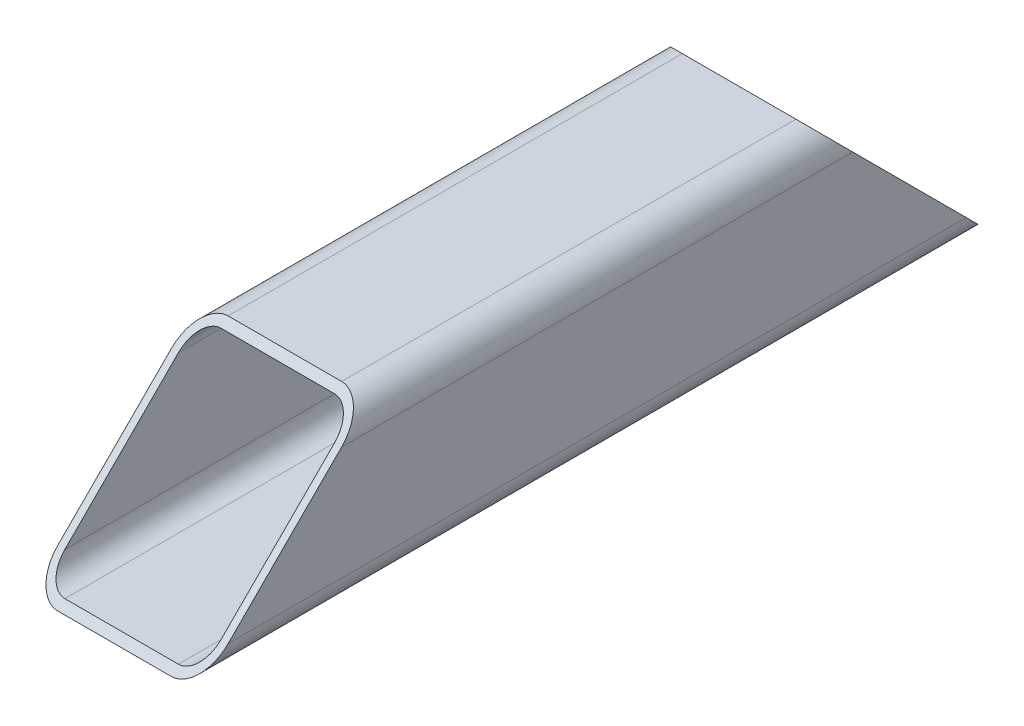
SolidWorks part; units mm, degrees
ref_plane "Front" through (0, 0, 0) normal (0, 0, 1) x (1, 0, 0)
ref_plane "Top" through (0, 0, 0) normal (0, 1, 0) x (1, 0, 0)
ref_plane "Right" through (0, 0, 0) normal (1, 0, 0) x (0, 0, -1)
sketch "Sketch1" plane through (0, 0, 0) normal (0, 0, 1) x (1, 0, 0)
  line L0 (-25.4, 38.1) -> (25.4, 38.1)
  line L1 (-38.1, 25.4) -> (-38.1, -25.4)
  line L2 (25.4, -38.1) -> (-25.4, -38.1)
  line L3 (38.1, -25.4) -> (38.1, 25.4)
  line L4 (0, 38.1) -> (0, -38.1) construction
  arc A0 (38.1, 25.4) -> (25.4, 38.1) centre (25.4, 25.4) ccw
  arc A1 (38.1, -25.4) -> (25.4, -38.1) centre (25.4, -25.4) cw
  arc A2 (-25.4, -38.1) -> (-38.1, -25.4) centre (-25.4, -25.4) cw
  arc A3 (-38.1, 25.4) -> (-25.4, 38.1) centre (-25.4, 25.4) cw
  dimension "D1" = 12.7
  dimension "D2" = 76.2
  dimension "D3" = 76.2
extrude "Base-Extrude-Thin" add sketch "Sketch1" along normal blind 355.6 thin
sketch "Sketch2" plane through (38.1, 0, 0) normal (1, 0, 0) x (0, 0, -1)
  line L0 (-355.6, -38.1) -> (-279.4, 38.1)
  line L1 (-355.6, 38.1) -> (0, 38.1) construction
  line L2 (-355.6, -25.4) -> (-355.6, 25.4) construction
  dimension "D1" = 45
extrude "Cut-Extrude1" cut sketch "Sketch2" against normal through all
sketch "Sketch3" plane through (38.1, 0, 0) normal (1, 0, 0) x (0, 0, -1)
  line L0 (0, -38.1) -> (-76.2, 38.1)
  line L1 (0, -25.4) -> (0, 25.4) construction
  line L2 (-279.4, 38.1) -> (0, 38.1) construction
  dimension "D1" = 45
extrude "Cut-Extrude2" cut sketch "Sketch3" against normal through all flip side to cut
